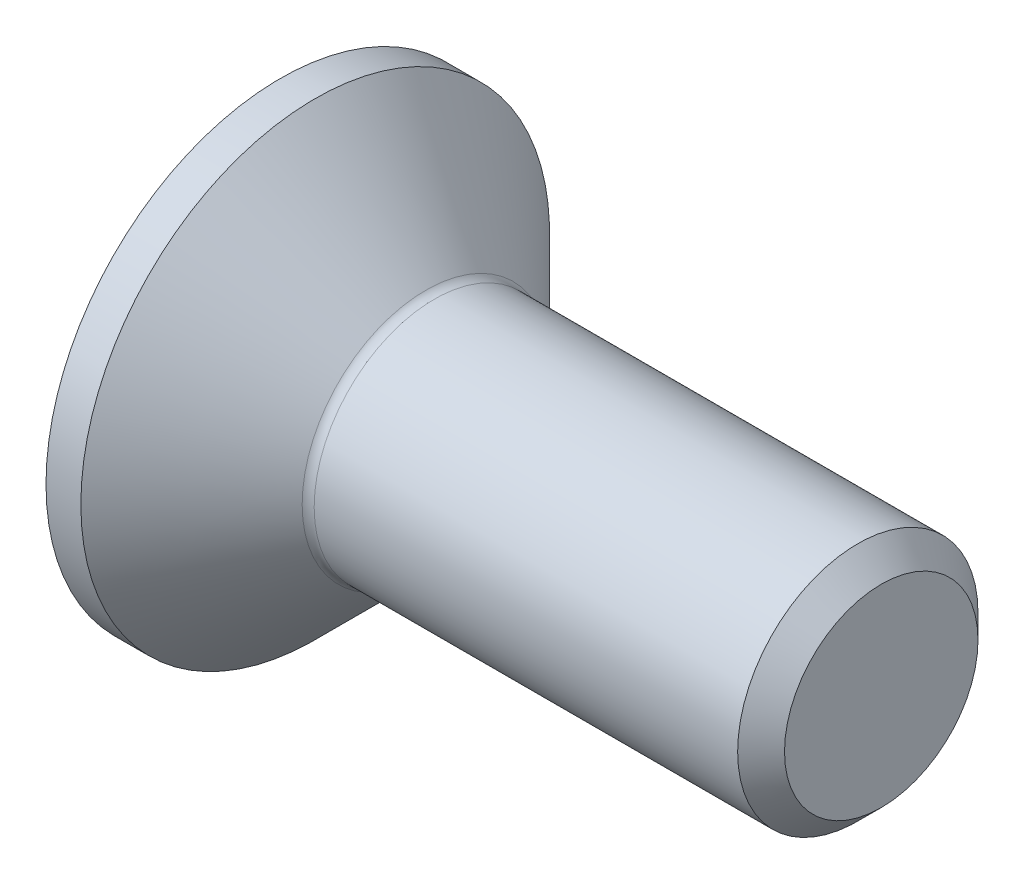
SolidWorks part; units mm, degrees
ref_plane "Plane1" through (0, 0, 0) normal (0, 0, 1) x (1, 0, 0)
ref_plane "Plane2" through (0, 0, 0) normal (0, 1, 0) x (1, 0, 0)
ref_plane "Plane3" through (0, 0, 0) normal (1, 0, 0) x (0, 0, -1)
sketch "BodySke" plane through (0, 0, 0) normal (0, 0, 1) x (1, 0, 0)
  line L0 (0, 0) -> (0, 3.9)
  line L1 (0.58, 3.9) -> (2.48, 2)
  line L2 (0, 3.9) -> (0.58, 3.9)
  line L3 (2.48, 2) -> (9.61, 2)
  line L4 (10, 1.61) -> (10, 0)
  line L5 (10, 0) -> (0, 0)
  line L6 (0, 0) -> (127, 0) construction
  line L7 (0.58, -3.9) -> (2.48, -2) construction
  line L8 (10, 1.61) -> (9.61, 2)
  line L9 (0, -3.9) -> (0.58, -3.9) construction
  line L10 (10, -1.61) -> (9.61, -2) construction
  line L11 (3.18, 8.35) -> (3.18, -13.875) construction
  line L12 (0, 19.05) -> (0, -3.175) construction
  dimension "D1" = 0.58
  dimension "Diameter" = 4
  dimension "Head_ht" = 2.48
  dimension "Length" = 10
  dimension "Body_ch_ang" = 45
  dimension "Head_dia" = 7.8
  dimension "Minor_dia" = 3.22
  dimension "Head_ang" = 90
  dimension "Advance" = 0.7
  dimension "Thread_nom" = 10
revolve "BaseBody" add sketch "BodySke" angle 360 about L6
fillet "Fillet1" radius 0.2 1 edges at (2.48, 0, 2)
sketch "Sketch2" plane through (0, 0, 0) normal (0, 0, 1) x (1, 0, 0)
  line L0 (0, 1.25) -> (1.5, 1.25)
  line L1 (1.5, 1.25) -> (2.2217, 0)
  line L2 (0, 0) -> (127, 0) construction
  line L3 (2.2217, 0) -> (0, 0)
  line L4 (0, 0) -> (0, 1.25)
  line L5 (0, -1.25) -> (1.5, -1.25) construction
  line L6 (0, 0) -> (47.625, 0) construction
  line L8 (0, 3.9) -> (0, -3.9) construction
  dimension "D2" = 60
  dimension "PreBroach_depth" = 1.5
  dimension "PreBroach_dia" = 2.5
revolve "PreBroach" cut sketch "Sketch2" angle 360 about L6
sketch "Sketch3" plane through (0, 0, 0) normal (-1, 0, 0) x (0, 0, 1)
  line L0 (-1.25, -0.7217) -> (-1.25, 0.7217)
  line L1 (-1.25, 0.7217) -> (0, 1.4434)
  line L2 (0, 1.4434) -> (1.25, 0.7217)
  line L3 (1.25, 0.7217) -> (1.25, -0.7217)
  line L4 (1.25, -0.7217) -> (0, -1.4434)
  line L5 (0, -1.4434) -> (-1.25, -0.7217)
  dimension "D1" = 1.25
  dimension "D2" = 1.25
  dimension "D3" = 2.5
  dimension "Hex_size" = 2.5
extrude "Hex" cut sketch "Sketch3" against normal blind 1.5
sketch "ThdSchSke" plane through (0, 0, 0) normal (0, 0, 1) x (1, 0, 0)
  line L0 (3.88, -1.61) -> (3.6069, -2)
  line L1 (3.88, -1.61) -> (4.1531, -2)
  line L2 (4.1531, -2) -> (4.1531, -2.5)
  line L3 (-3.175, 0) -> (5.1513, 0) construction
  line L4 (0, 3.9) -> (0, -3.9) construction
  line L5 (4.1531, -2.5) -> (3.6069, -2.5)
  line L6 (3.6069, -2.5) -> (3.6069, -2)
  dimension "Thread_minor" = 3.22
  dimension "Diameter" = 4
  dimension "Start" = 3.88
  dimension "SideAngle" = 55
  dimension "VeeAngle" = 70
  dimension "Overcut" = 5
revolve "ThreadSchematic" [suppressed] cut sketch "ThdSchSke" angle 360 about L3
pattern_linear "ThdSchPat" [suppressed]
equation "\"Thread_minor@ThreadCosmetic\"  =  \"Minor_dia@BodySke\""
equation "\"D1@Sketch3\" = \"Hex_size@Sketch3\" / 2"
equation "\"D2@Sketch3\" = \"D1@Sketch3\""
equation "\"D3@Sketch3\" = \"Hex_size@Sketch3\""
equation "\"Thread_length@ThreadCosmetic\" = ((sgn( (\"Length@BodySke\" - \"Advance@BodySke\" * 2.0 - \"Head_ht@BodySke\" ) - \"Thread_nom@BodySke\" )-1)*( (\"Length@BodySke\" - \"Advance@BodySke\" * 2.0 - \"Head_ht@BodySke\" "
equation "\"Thread_minor@ThdSchSke\" = \"Minor_dia@BodySke\""
equation "\"Diameter@ThdSchSke\" = \"Diameter@BodySke\""
equation "\"Overcut@ThdSchSke\" = \"Diameter@BodySke\" * 1.25"
equation "\"Start@ThdSchSke\" = 0.000001 + \"Length@BodySke\" - \"Thread_length@ThreadCosmetic\"  '---Countersunk---"
equation "\"Num_threads@ThdSchPat\" = int( \"Thread_length@ThreadCosmetic\" / \"Advance@BodySke\" + 0.999 )  + 1"
equation "\"Advance@ThdSchPat\" = \"Thread_length@ThreadCosmetic\" /  (\"Num_threads@ThdSchPat\" - 1) 'relax it"
equation "\"Num_threads@ThdSchPat\" = \"Num_threads@ThdSchPat\" - sgn( \"Num_threads@ThdSchPat\" - 1) '---chamfered tips only---"
